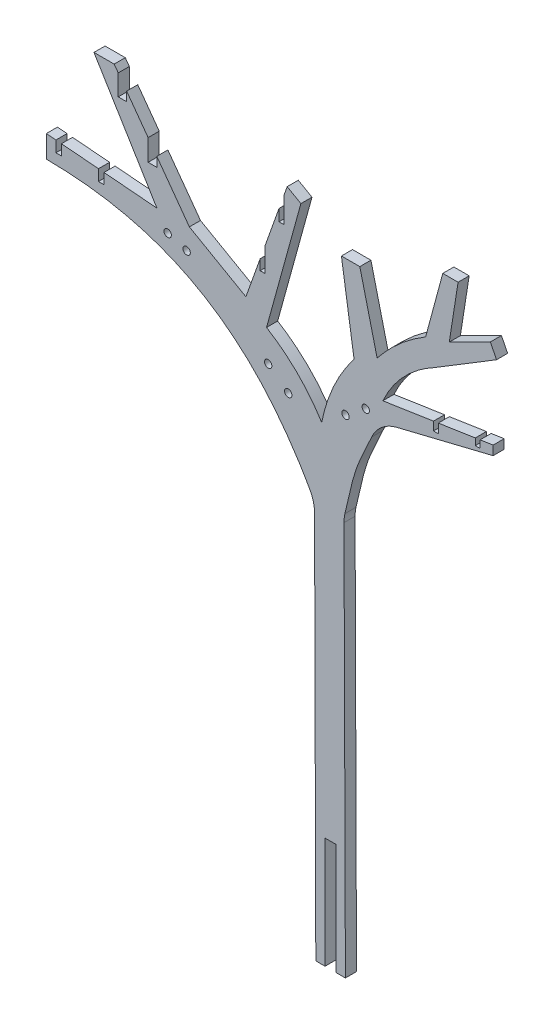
SolidWorks part; units mm, degrees
ref_plane "Plan de face" through (0, 0, 0) normal (0, 0, 1) x (1, 0, 0)
ref_plane "Plan de dessus" through (0, 0, 0) normal (0, 1, 0) x (1, 0, 0)
ref_plane "Plan de droite" through (0, 0, 0) normal (1, 0, 0) x (0, 0, -1)
sketch "Esquisse1" plane through (0, 0, 0) normal (0, 0, 1) x (1, 0, 0)
  line L0 (2.5166, 61.05) -> (2.1775, 165.7435)
  line L26 (6.3123, 62.4707) -> (6.3123, 126.3454) construction
  line L27 (10.5166, 61.05) -> (10.132, 167.4254)
  line L28 (-70.3001, 212.2785) -> (-70.3001, 218.2785)
  line L29 (-70.3001, 218.2785) -> (-40.4167, 215.754)
  line L30 (-40.4167, 215.754) -> (-57.4328, 243.6942)
  line L31 (-57.4328, 243.6942) -> (-51.9703, 243.6942)
  line L32 (-51.9703, 243.6942) -> (-31.6457, 215.754)
  line L33 (-16.3778, 207.0377) -> (-5.2173, 238.3894)
  line L34 (-5.2173, 238.3894) -> (-1.5106, 236.2739)
  line L35 (-1.5106, 236.2739) -> (-10.7937, 202.6424)
  line L36 (12.8538, 207.0377) -> (9.4392, 229.4916)
  line L37 (9.4392, 229.4916) -> (14.4129, 229.4916)
  line L38 (14.4129, 229.4916) -> (19.0919, 210.4084)
  line L39 (32.1979, 221.9272) -> (36.8329, 239.1137)
  line L40 (36.8329, 239.1137) -> (40.9623, 239.1137)
  line L41 (40.9623, 239.1137) -> (38.5861, 223.9048)
  line L42 (49.685, 229.4916) -> (51.3622, 226.1597)
  line L43 (51.3622, 226.1597) -> (34.5613, 215.9275)
  line L44 (20.6343, 201.1979) -> (50.4311, 205.7291)
  line L45 (50.4311, 205.7291) -> (50.4311, 203.2421)
  line L46 (50.4311, 203.2421) -> (24.3642, 196.8508)
  line L47 (2.5166, 61.05) -> (10.5166, 61.05)
  arc A15 (24.3642, 196.8508) -> (17.6108, 191.2074) centre (26.7455, 187.1385) ccw
  arc A16 (10.132, 167.4254) -> (10.3749, 169.6525) centre (20.1319, 167.4615) cw
  arc A17 (2.1775, 165.7435) -> (0.9545, 170.4792) centre (-7.7271, 165.7114) ccw
  spline S0 degree 3 poles (0.9545, 170.4792) (-1.2284, 174.4541) (-17.8927, 200.2965) (-42.1501, 212.0934) (-70.3001, 212.2785) knots 0.022769 0.022769 0.022769 0.022769 0.195051 1 1 1 1
  spline S1 degree 1 poles (-31.6457, 215.754) (-16.3778, 207.0377) knots 0 0 1 1
  spline S2 degree 2 poles (-10.7937, 202.6424) (-1.6054, 197.0096) (4.1086, 187.8736) knots 0 0 0 1 1 1
  spline S3 degree 2 poles (4.1086, 187.8736) (6.2382, 198.4955) (12.8538, 207.0377) knots 0 0 0 1 1 1
  spline S4 degree 2 poles (19.0919, 210.4084) (24.6018, 217.3894) (32.1979, 221.9272) knots 0 0 0 1 1 1
  spline S5 degree 2 poles (38.5861, 223.9048) (44.1356, 226.6982) (49.685, 229.4916) knots 0 0 0 1 1 1
  spline S6 degree 2 poles (34.5613, 215.9275) (24.9962, 210.7562) (20.6343, 201.1979) knots 0 0 0 1 1 1
  spline S7 degree 3 poles (17.6108, 191.2074) (16.0957, 187.8061) (13.3154, 182.0265) (12.3606, 178.4954) (10.3749, 169.6525) knots 0.094316 0.094316 0.094316 0.094316 0.397348 0.983635 0.983635 0.983635 0.983635
  point P2 (-2.4516, 237.0407)
  point P3 (-4.8699, 238.1912)
  point P6 (-1.5106, 236.2739)
  point P42 (43.9974, 239.1061)
  point P43 (40.9623, 239.1137)
  point P46 (50.4311, 205.7291)
  dimension "D1" = 9.9047
  dimension "D4" = 10
  dimension "D3" = 10
  dimension "D2" = 6
  dimension "D5" = 5.4625
  dimension "D6" = 8
extrude "Boss.-Extru.1" add sketch "Esquisse1" along normal blind 3
sketch "Esquisse2" plane through (0, 0, 3) normal (0, 0, 1) x (1, 0, 0)
  line L0 (-40.4167, 215.754) -> (-70.3001, 218.2785) construction
  line L1 (-67.7162, 218.0603) -> (-66.2162, 218.0603)
  line L2 (-67.7162, 218.0603) -> (-67.7162, 215.0603)
  line L3 (-67.7162, 215.0603) -> (-66.2162, 215.0603)
  line L4 (-66.2162, 218.0603) -> (-66.2162, 215.0603)
  line L6 (-56.2162, 217.0887) -> (-54.7162, 217.0887)
  line L7 (-56.2162, 217.0887) -> (-56.2162, 214.0887)
  line L8 (-56.2162, 214.0887) -> (-54.7162, 214.0887)
  line L9 (-54.7162, 217.0887) -> (-54.7162, 214.0887)
  line L22 (50.4311, 205.7291) -> (20.6343, 201.1979) construction
  line L23 (46.9134, 205.1941) -> (45.6134, 205.1941)
  line L24 (46.9134, 205.1941) -> (46.9134, 203.1941)
  line L25 (46.9134, 203.1941) -> (45.6134, 203.1941)
  line L26 (45.6134, 205.1941) -> (45.6134, 203.1941)
  line L27 (-5.2173, 238.3894) -> (-16.3778, 207.0377) construction
  line L28 (35.6134, 203.4757) -> (34.3134, 203.4757)
  line L29 (35.6134, 203.4757) -> (35.6134, 200.9757)
  line L30 (35.6134, 200.9757) -> (34.3134, 200.9757)
  line L31 (34.3134, 203.4757) -> (34.3134, 200.9757)
  line L32 (-6.1229, 235.8454) -> (-7.4229, 235.8454)
  line L33 (-6.1229, 235.8454) -> (-6.1229, 229.0551)
  line L34 (-6.1229, 229.0551) -> (-7.4229, 229.0551)
  line L35 (-7.4229, 235.8454) -> (-7.4229, 229.0551)
  line L36 (-31.6457, 215.754) -> (-51.9703, 243.6942) construction
  line L37 (-11.2238, 221.5163) -> (-12.5238, 221.5163)
  line L38 (-11.2238, 221.5163) -> (-11.2238, 215.0603)
  line L39 (-11.2238, 215.0603) -> (-12.5238, 215.0603)
  line L40 (-12.5238, 221.5163) -> (-12.5238, 215.0603)
  line L41 (-50.87, 242.1816) -> (-48.5974, 242.1816)
  line L42 (-50.87, 242.1816) -> (-50.87, 236.5704)
  line L43 (-50.87, 236.5704) -> (-48.5974, 236.5704)
  line L44 (-48.5974, 242.1816) -> (-48.5974, 236.5704)
  line L46 (-42.7936, 231.0789) -> (-40.4548, 231.0789)
  line L47 (-42.7936, 231.0789) -> (-42.7936, 225.2961)
  line L48 (-42.7936, 225.2961) -> (-40.4548, 225.2961)
  line L49 (-40.4548, 231.0789) -> (-40.4548, 225.2961)
  circle A0 centre (-37.5165, 211.3561) radius 1
  circle A1 centre (-32.3899, 209.8136) radius 1
  circle A2 centre (-10.3525, 194.3506) radius 1
  circle A3 centre (-4.9324, 190.1987) radius 1
  circle A4 centre (10.5349, 192.8426) radius 1
  circle A5 centre (16.012, 197.0098) radius 1
  point P32 (45.6134, 204.1941)
  dimension "D1" = 2
  dimension "D2" = 2
  dimension "D3" = 2
  dimension "D4" = 1.5
  dimension "D5" = 3
  dimension "D6" = 1.5
  dimension "D7" = 3
  dimension "D8" = 10
  dimension "D9" = 1.3
  dimension "D10" = 2
  dimension "D11" = 1.3
  dimension "D12" = 2.5
  dimension "D13" = 10
  dimension "D14" = 1.3
  dimension "D15" = 1.3
extrude "Enlèv. mat.-Extru.1" cut sketch "Esquisse2" against normal blind 3
sketch "Esquisse3" plane through (0, 0, 3) normal (0, 0, 1) x (1, 0, 0)
  line L0 (2.5166, 61.05) -> (10.5166, 61.05) construction
  line L1 (5.0166, 61.05) -> (8.0166, 61.05)
  line L2 (5.0166, 61.05) -> (5.0166, 91.05)
  line L3 (5.0166, 91.05) -> (8.0166, 91.05)
  line L4 (8.0166, 61.05) -> (8.0166, 91.05)
  line L5 (6.5166, 91.05) -> (6.5166, 61.05) construction
  point P12 (6.5166, 61.05)
  dimension "D1" = 3
  dimension "D2" = 30
extrude "Enlèv. mat.-Extru.2" cut sketch "Esquisse3" against normal blind 10
